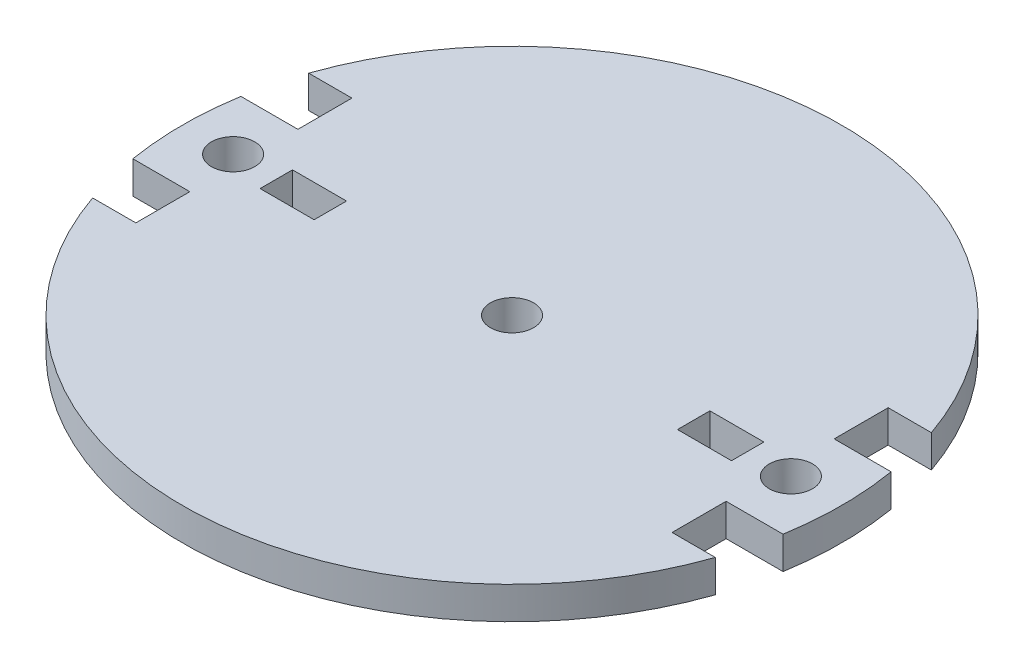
SolidWorks part; units mm, degrees
ref_plane "Alzado" through (0, 0, 0) normal (0, 0, 1) x (1, 0, 0)
ref_plane "Planta" through (0, 0, 0) normal (0, 1, 0) x (1, 0, 0)
ref_plane "Vista lateral" through (0, 0, 0) normal (1, 0, 0) x (0, 0, -1)
sketch "Croquis1" plane through (0, 0, 0) normal (0, 1, 0) x (1, 0, 0)
  circle A0 centre (0, 0) radius 30.5
extrude "Saliente-Extruir1" add sketch "Croquis1" along normal blind 3
sketch "Croquis2" plane through (0, 3, 0) normal (0, 1, 0) x (1, 0, 0)
  circle A0 centre (0, 0) radius 2
extrude "Cortar-Extruir1" cut sketch "Croquis2" against normal blind 4
sketch "Croquis5" plane through (0, 3, 0) normal (0, 1, 0) x (1, 0, 0)
  line L0 (0, 0) -> (0, 10)
  line L1 (28.8141, -5) -> (30.0874, -5)
  line L2 (28.8141, 5) -> (30.0874, 5)
  line L3 (-24.8141, 10) -> (-28.8141, 10)
  line L4 (24.8141, -5) -> (24.8141, -10)
  line L5 (-24.8141, -10) -> (-28.8141, -10)
  line L6 (24.8141, -5) -> (28.8141, -5)
  line L7 (24.8141, 5) -> (24.8141, 10)
  line L8 (-24.8141, 5) -> (-28.8141, 5)
  line L9 (-24.8141, 5) -> (-24.8141, 10)
  line L10 (-24.8141, -5) -> (-28.8141, -5)
  line L11 (-24.8141, -5) -> (-24.8141, -10)
  line L12 (24.8141, 5) -> (28.8141, 5)
  line L13 (24.8141, -10) -> (28.8141, -10)
  line L14 (24.8141, 10) -> (28.8141, 10)
  line L15 (-28.8141, 5) -> (-30.0874, 5)
  line L16 (-28.8141, -5) -> (-30.0874, -5)
  circle A1 centre (0, 0) radius 30.5 construction
  arc A2 (-28.8141, 10) -> (-30.0874, 5) centre (0, 0) ccw
  arc A3 (28.8141, 10) -> (28.8141, -10) centre (0, 0) cw
  arc A4 (-30.0874, -5) -> (-28.8141, -10) centre (0, 0) ccw
  arc A5 (30.0874, -5) -> (28.8141, -10) centre (0, 0) cw
  arc A6 (28.8141, 10) -> (30.0874, 5) centre (0, 0) cw
extrude "Cortar-Extruir3" cut sketch "Croquis5" against normal blind 4
sketch "Croquis6" plane through (0, 3, 0) normal (0, 1, 0) x (1, 0, 0)
  line L0 (16.8141, 1.5) -> (21.8141, 1.5)
  line L1 (-16.8141, 1.5) -> (-16.8141, -1.5)
  line L2 (-16.8141, -1.5) -> (-21.8141, -1.5)
  line L3 (-21.8141, -1.5) -> (-21.8141, 1.5)
  line L5 (-16.8141, 1.5) -> (-21.8141, 1.5)
  line L6 (21.8141, -1.5) -> (21.8141, 1.5)
  line L7 (16.8141, -1.5) -> (21.8141, -1.5)
  line L8 (16.8141, 1.5) -> (16.8141, -1.5)
extrude "Cortar-Extruir4" cut sketch "Croquis6" against normal blind 4
sketch "Croquis7" plane through (0, 3, 0) normal (0, 1, 0) x (1, 0, 0)
  circle A1 centre (-25.8141, 0) radius 2
  circle A2 centre (25.8141, 0) radius 2
extrude "Cortar-Extruir5" cut sketch "Croquis7" against normal blind 4
